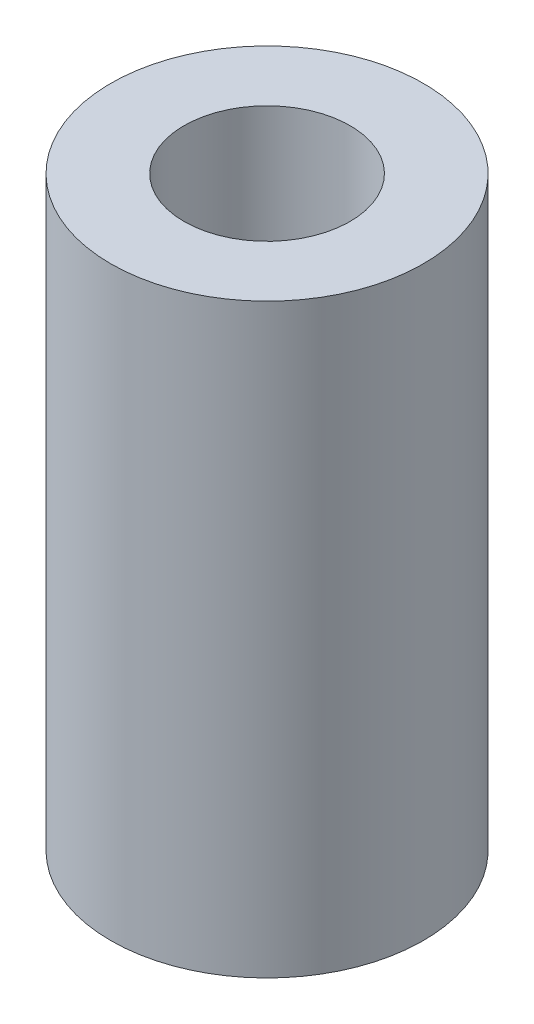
SolidWorks part; units mm, degrees
ref_plane "Plan de face" through (0, 0, 0) normal (0, 0, 1) x (1, 0, 0)
ref_plane "Plan de dessus" through (0, 0, 0) normal (0, 1, 0) x (1, 0, 0)
ref_plane "Plan de droite" through (0, 0, 0) normal (1, 0, 0) x (0, 0, -1)
sketch "Esquisse1" plane through (0, 0, 0) normal (0, 1, 0) x (1, 0, 0)
  circle A0 centre (0, 0) radius 2.125
  circle A1 centre (0, 0) radius 4
  dimension "D1" = 4.25
  dimension "D2" = 8
extrude "Boss.-Extru.1" add sketch "Esquisse1" along normal mid plane 15
